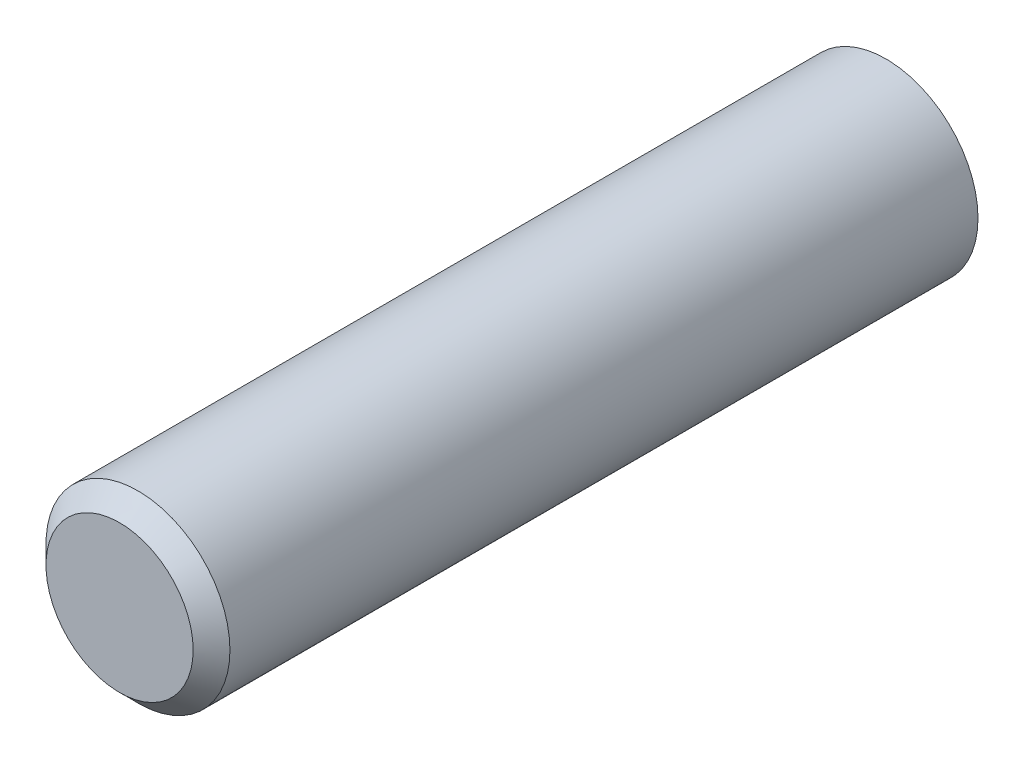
SolidWorks part; units mm, degrees
ref_plane "Front Plane" through (0, 0, 0) normal (0, 0, 1) x (1, 0, 0)
ref_plane "Top Plane" through (0, 0, 0) normal (0, 1, 0) x (1, 0, 0)
ref_plane "Right Plane" through (0, 0, 0) normal (1, 0, 0) x (0, 0, -1)
sketch "Sketch1" plane through (0, 0, 0) normal (0, 0, 1) x (1, 0, 0)
  circle A0 centre (0, 0) radius 6
  dimension "D1" = 12
extrude "Boss-Extrude1" add sketch "Sketch1" along normal mid plane 50
chamfer "Chamfer1" distance 1.2 angle 45 1 edges at (6, 0, 25)
